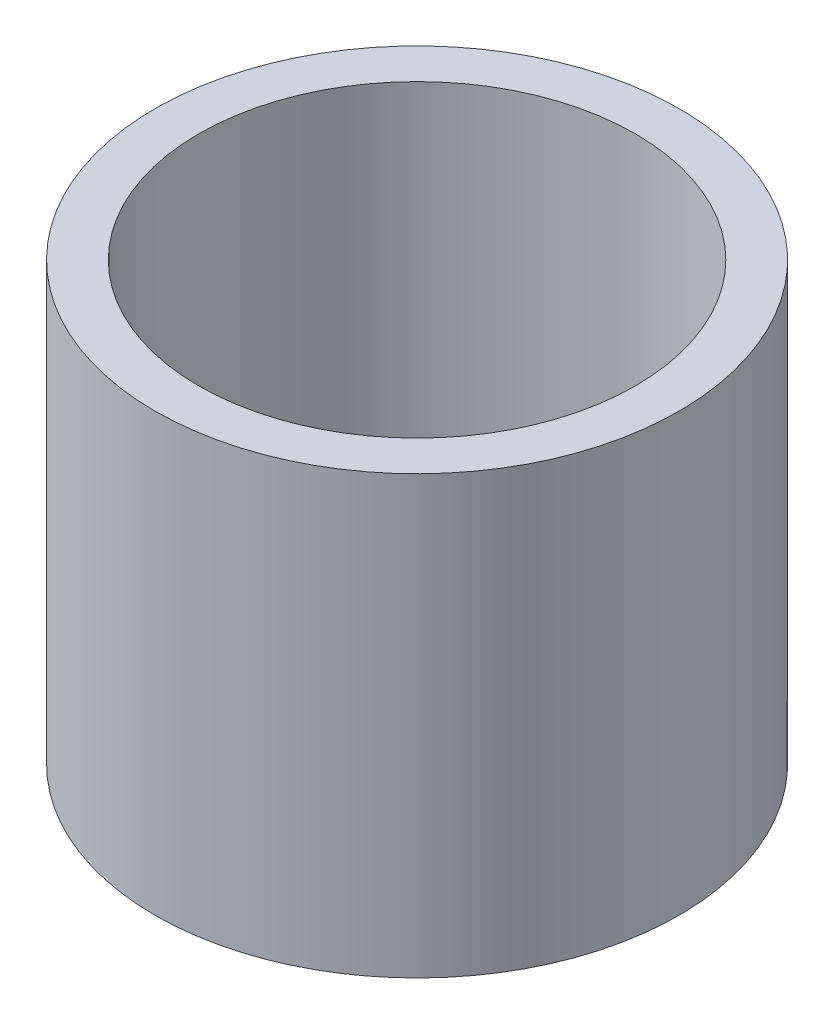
SolidWorks part; units mm, degrees
ref_plane "Front Plane" through (0, 0, 0) normal (0, 0, 1) x (1, 0, 0)
ref_plane "Top Plane" through (0, 0, 0) normal (0, 1, 0) x (1, 0, 0)
ref_plane "Right Plane" through (0, 0, 0) normal (1, 0, 0) x (0, 0, -1)
sketch "Sketch1" plane through (0, 0, 0) normal (0, 1, 0) x (1, 0, 0)
  circle A0 centre (0, 0) radius 5
  circle A1 centre (0, 0) radius 6
  dimension "D1" = 10
  dimension "D2" = 1
extrude "Boss-Extrude1" add sketch "Sketch1" along normal blind 10
